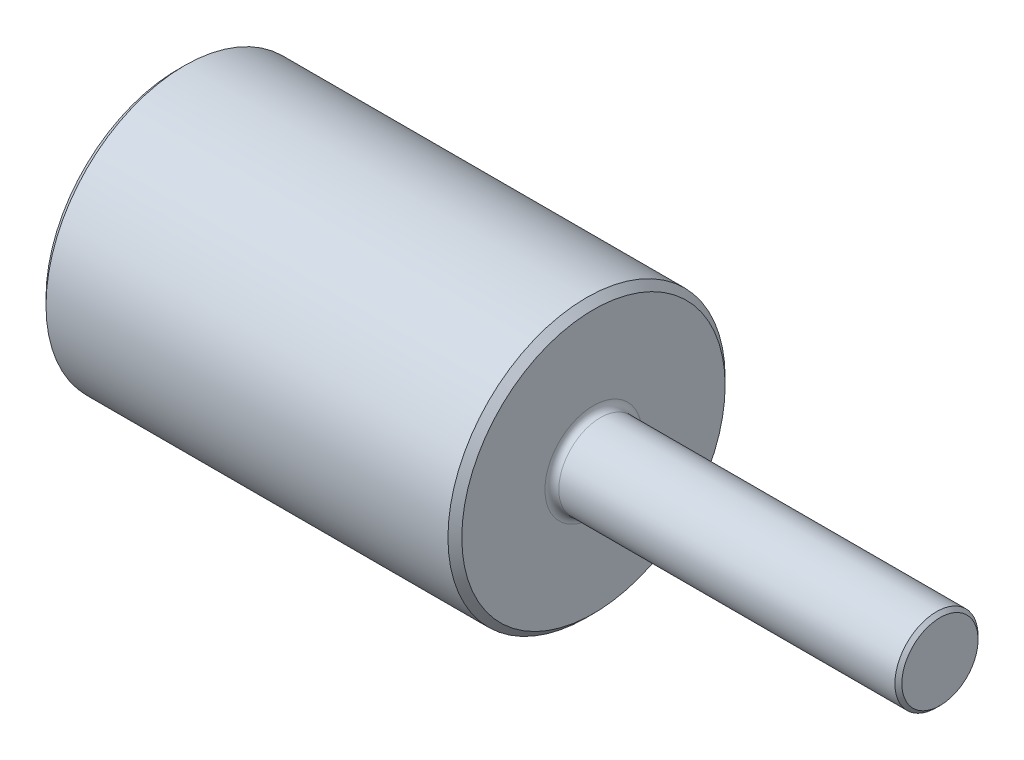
SolidWorks part; units mm, degrees
ref_plane "Face" through (0, 0, 0) normal (0, 0, 1) x (1, 0, 0)
ref_plane "Dessus" through (0, 0, 0) normal (0, 1, 0) x (1, 0, 0)
ref_plane "Droite" through (0, 0, 0) normal (1, 0, 0) x (0, 0, -1)
sketch "Esquisse1" plane through (0, 0, 0) normal (0, 0, 1) x (1, 0, 0)
  line L0 (0, 0) -> (0, 3)
  line L1 (0, 3) -> (-25, 3)
  line L2 (-25, 3) -> (-25, 10)
  line L3 (-25, 10) -> (-55, 10)
  line L4 (-55, 10) -> (-55, 0)
  line L5 (-55, 0) -> (0, 0)
  line L6 (-58.6699, 0) -> (11.4034, 0) construction
  dimension "D1" = 3
  dimension "D2" = 25
  dimension "D3" = 10
  dimension "D4" = 30
revolve "Base-Révolution" add sketch "Esquisse1" angle 360 about L6
chamfer "Chanfrein1" distance 0.25 angle 45 1 edges at (0, 0, 3)
chamfer "Chanfrein3" distance 0.5 angle 45 2 edges at (-55, 0, 10) (-25, 0, 10)
fillet "Congé1" radius 0.5 1 edges at (-25, 0, 3)
sketch "Esq_WRNL_Compact001" plane through (0, 0, 0) normal (0, 0, 1) x (1, 0, 0)
  line L0 (-56, -11) -> (-56, 11)
  line L1 (1, -11) -> (1, 11)
  line L2 (-56, -11) -> (1, -11)
  line L3 (-56, 11) -> (1, 11)
